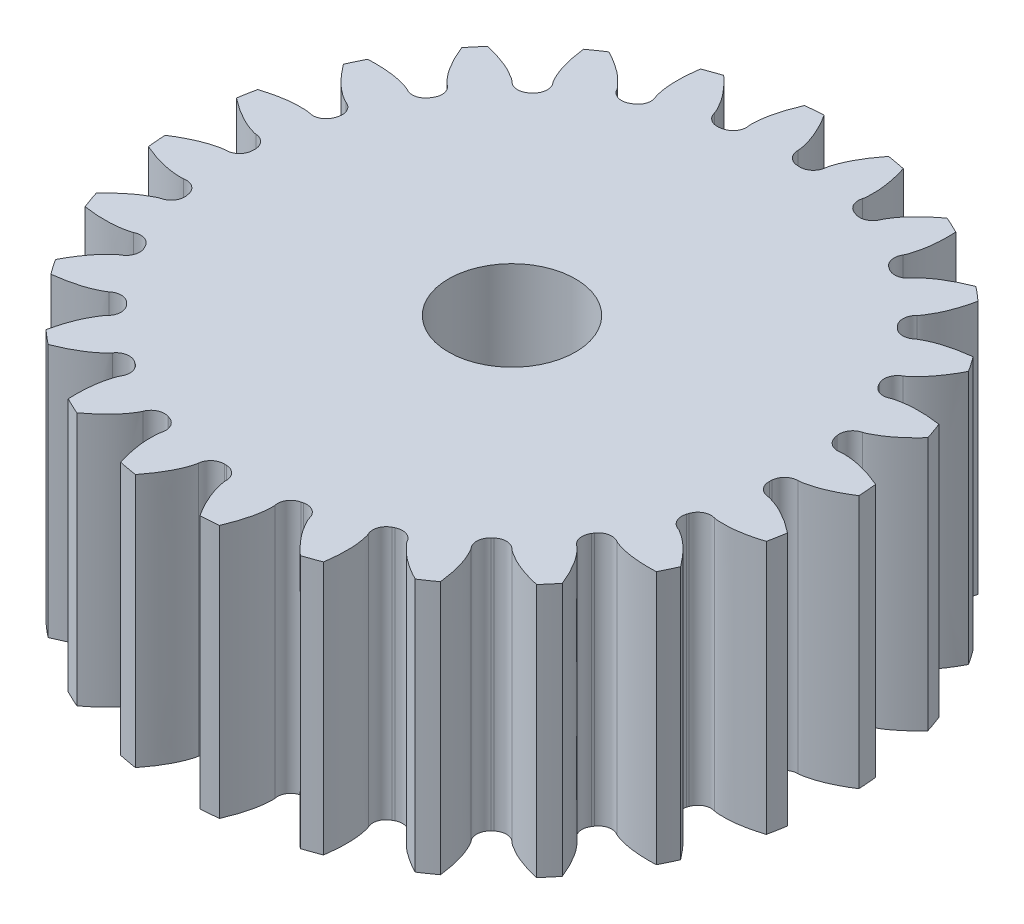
SolidWorks part; units mm, degrees
ref_plane "Face" through (0, 0, 0) normal (0, 0, 1) x (1, 0, 0)
ref_plane "Dessus" through (0, 0, 0) normal (0, 1, 0) x (1, 0, 0)
ref_plane "Droite" through (0, 0, 0) normal (1, 0, 0) x (0, 0, -1)
sketch "Esquisse1" plane through (0, 0, 0) normal (0, 1, 0) x (1, 0, 0)
  circle A0 centre (0, 0) radius 5.2
  circle A1 centre (0, 0) radius 1
  dimension "D1" = 10.4
  dimension "D2" = 2
extrude "Boss.-Extru.1" add sketch "Esquisse1" along normal blind 4
sketch "Esquisse2" plane through (0, 4, 0) normal (0, 1, 0) x (1, 0, 0)
  arc A0 (5.1928, 0.2742) -> (5.1697, 0.5603) centre (0, 0) ccw
  arc A1 (4.9449, 1.6088) -> (4.8486, 1.8792) centre (0, 0) ccw
  arc A2 (4.36, 2.8338) -> (4.197, 3.0701) centre (0, 0) ccw
  arc A3 (3.478, 3.8657) -> (3.2593, 4.0517) centre (0, 0) ccw
  arc A4 (2.359, 4.6342) -> (2.0996, 4.7573) centre (0, 0) ccw
  arc A5 (1.0792, 5.0868) -> (0.7968, 5.1386) centre (0, 0) ccw
  arc A6 (-0.2742, 5.1928) -> (-0.5603, 5.1697) centre (0, 0) ccw
  arc A7 (-1.6088, 4.9449) -> (-1.8792, 4.8486) centre (0, 0) ccw
  arc A8 (-2.8338, 4.36) -> (-3.0701, 4.197) centre (0, 0) ccw
  arc A9 (-3.8657, 3.478) -> (-4.0517, 3.2593) centre (0, 0) ccw
  arc A10 (-4.6342, 2.359) -> (-4.7573, 2.0996) centre (0, 0) ccw
  arc A11 (-5.0868, 1.0792) -> (-5.1386, 0.7968) centre (0, 0) ccw
  arc A12 (-5.1928, -0.2742) -> (-5.1697, -0.5603) centre (0, 0) ccw
  arc A13 (-4.9449, -1.6088) -> (-4.8486, -1.8792) centre (0, 0) ccw
  arc A14 (-4.36, -2.8338) -> (-4.197, -3.0701) centre (0, 0) ccw
  arc A15 (-3.478, -3.8657) -> (-3.2593, -4.0517) centre (0, 0) ccw
  arc A16 (-2.359, -4.6342) -> (-2.0996, -4.7573) centre (0, 0) ccw
  arc A17 (-1.0792, -5.0868) -> (-0.7968, -5.1386) centre (0, 0) ccw
  arc A18 (0.2742, -5.1928) -> (0.5603, -5.1697) centre (0, 0) ccw
  arc A19 (1.6088, -4.9449) -> (1.8792, -4.8486) centre (0, 0) ccw
  arc A20 (2.8338, -4.36) -> (3.0701, -4.197) centre (0, 0) ccw
  arc A21 (3.8657, -3.478) -> (4.0517, -3.2593) centre (0, 0) ccw
  arc A22 (4.6342, -2.359) -> (4.7573, -2.0996) centre (0, 0) ccw
  arc A23 (5.0868, -1.0792) -> (5.1386, -0.7968) centre (0, 0) ccw
  arc A24 (4.511, 0) -> (4.2953, -0.2011) centre (4.5061, -0.2109) ccw
  arc A25 (4.2937, -0.2334) -> (4.488, -0.4552) centre (4.5043, -0.2449) ccw
  arc A26 (4.2937, -0.2334) -> (4.2953, -0.2011) centre (0, 0) ccw
  arc A27 (4.3573, 1.1675) -> (4.201, 0.9175) centre (4.4071, 0.9625) ccw
  arc A28 (4.2078, 0.8858) -> (4.4529, 0.7218) centre (4.4142, 0.9293) ccw
  arc A29 (4.2078, 0.8858) -> (4.201, 0.9175) centre (0, 0) ccw
  arc A30 (3.9066, 2.2555) -> (3.8204, 1.9735) centre (4.0078, 2.0704) ccw
  arc A31 (3.8351, 1.9447) -> (4.1143, 1.8497) centre (4.0233, 2.0401) ccw
  arc A32 (3.8351, 1.9447) -> (3.8204, 1.9735) centre (0, 0) ccw
  arc A33 (3.1898, 3.1898) -> (3.1794, 2.8951) centre (3.3354, 3.0371) ccw
  arc A34 (3.2011, 2.871) -> (3.4954, 2.8516) centre (3.3582, 3.0119) ccw
  arc A35 (3.2011, 2.871) -> (3.1794, 2.8951) centre (0, 0) ccw
  arc A36 (2.2555, 3.9066) -> (2.3218, 3.6193) centre (2.4357, 3.7969) ccw
  arc A37 (2.349, 3.6017) -> (2.6382, 3.6591) centre (2.4642, 3.7784) ccw
  arc A38 (2.349, 3.6017) -> (2.3218, 3.6193) centre (0, 0) ccw
  arc A39 (1.1675, 4.3573) -> (1.3059, 4.0969) centre (1.37, 4.2979) ccw
  arc A40 (1.3367, 4.0869) -> (1.6013, 4.2172) centre (1.4023, 4.2875) ccw
  arc A41 (1.3367, 4.0869) -> (1.3059, 4.0969) centre (0, 0) ccw
  arc A42 (0, 4.511) -> (0.2011, 4.2953) centre (0.2109, 4.5061) ccw
  arc A43 (0.2334, 4.2937) -> (0.4552, 4.488) centre (0.2449, 4.5043) ccw
  arc A44 (0.2334, 4.2937) -> (0.2011, 4.2953) centre (0, 0) ccw
  arc A45 (-1.1675, 4.3573) -> (-0.9175, 4.201) centre (-0.9625, 4.4071) ccw
  arc A46 (-0.8858, 4.2078) -> (-0.7218, 4.4529) centre (-0.9293, 4.4142) ccw
  arc A47 (-0.8858, 4.2078) -> (-0.9175, 4.201) centre (0, 0) ccw
  arc A48 (-2.2555, 3.9066) -> (-1.9735, 3.8204) centre (-2.0704, 4.0078) ccw
  arc A49 (-1.9447, 3.8351) -> (-1.8497, 4.1143) centre (-2.0401, 4.0233) ccw
  arc A50 (-1.9447, 3.8351) -> (-1.9735, 3.8204) centre (0, 0) ccw
  arc A51 (-3.1898, 3.1898) -> (-2.8951, 3.1794) centre (-3.0371, 3.3354) ccw
  arc A52 (-2.871, 3.2011) -> (-2.8516, 3.4954) centre (-3.0119, 3.3582) ccw
  arc A53 (-2.871, 3.2011) -> (-2.8951, 3.1794) centre (0, 0) ccw
  arc A54 (-3.9066, 2.2555) -> (-3.6193, 2.3218) centre (-3.7969, 2.4357) ccw
  arc A55 (-3.6017, 2.349) -> (-3.6591, 2.6382) centre (-3.7784, 2.4642) ccw
  arc A56 (-3.6017, 2.349) -> (-3.6193, 2.3218) centre (0, 0) ccw
  arc A57 (-4.3573, 1.1675) -> (-4.0969, 1.3059) centre (-4.2979, 1.37) ccw
  arc A58 (-4.0869, 1.3367) -> (-4.2172, 1.6013) centre (-4.2875, 1.4023) ccw
  arc A59 (-4.0869, 1.3367) -> (-4.0969, 1.3059) centre (0, 0) ccw
  arc A60 (-4.511, 0) -> (-4.2953, 0.2011) centre (-4.5061, 0.2109) ccw
  arc A61 (-4.2937, 0.2334) -> (-4.488, 0.4552) centre (-4.5043, 0.2449) ccw
  arc A62 (-4.2937, 0.2334) -> (-4.2953, 0.2011) centre (0, 0) ccw
  arc A63 (-4.3573, -1.1675) -> (-4.201, -0.9175) centre (-4.4071, -0.9625) ccw
  arc A64 (-4.2078, -0.8858) -> (-4.4529, -0.7218) centre (-4.4142, -0.9293) ccw
  arc A65 (-4.2078, -0.8858) -> (-4.201, -0.9175) centre (0, 0) ccw
  arc A66 (-3.9066, -2.2555) -> (-3.8204, -1.9735) centre (-4.0078, -2.0704) ccw
  arc A67 (-3.8351, -1.9447) -> (-4.1143, -1.8497) centre (-4.0233, -2.0401) ccw
  arc A68 (-3.8351, -1.9447) -> (-3.8204, -1.9735) centre (0, 0) ccw
  arc A69 (-3.1898, -3.1898) -> (-3.1794, -2.8951) centre (-3.3354, -3.0371) ccw
  arc A70 (-3.2011, -2.871) -> (-3.4954, -2.8516) centre (-3.3582, -3.0119) ccw
  arc A71 (-3.2011, -2.871) -> (-3.1794, -2.8951) centre (0, 0) ccw
  arc A72 (-2.2555, -3.9066) -> (-2.3218, -3.6193) centre (-2.4357, -3.7969) ccw
  arc A73 (-2.349, -3.6017) -> (-2.6382, -3.6591) centre (-2.4642, -3.7784) ccw
  arc A74 (-2.349, -3.6017) -> (-2.3218, -3.6193) centre (0, 0) ccw
  arc A75 (-1.1675, -4.3573) -> (-1.3059, -4.0969) centre (-1.37, -4.2979) ccw
  arc A76 (-1.3367, -4.0869) -> (-1.6013, -4.2172) centre (-1.4023, -4.2875) ccw
  arc A77 (-1.3367, -4.0869) -> (-1.3059, -4.0969) centre (0, 0) ccw
  arc A78 (0, -4.511) -> (-0.2011, -4.2953) centre (-0.2109, -4.5061) ccw
  arc A79 (-0.2334, -4.2937) -> (-0.4552, -4.488) centre (-0.2449, -4.5043) ccw
  arc A80 (-0.2334, -4.2937) -> (-0.2011, -4.2953) centre (0, 0) ccw
  arc A81 (1.1675, -4.3573) -> (0.9175, -4.201) centre (0.9625, -4.4071) ccw
  arc A82 (0.8858, -4.2078) -> (0.7218, -4.4529) centre (0.9293, -4.4142) ccw
  arc A83 (0.8858, -4.2078) -> (0.9175, -4.201) centre (0, 0) ccw
  arc A84 (2.2555, -3.9066) -> (1.9735, -3.8204) centre (2.0704, -4.0078) ccw
  arc A85 (1.9447, -3.8351) -> (1.8497, -4.1143) centre (2.0401, -4.0233) ccw
  arc A86 (1.9447, -3.8351) -> (1.9735, -3.8204) centre (0, 0) ccw
  arc A87 (3.1898, -3.1898) -> (2.8951, -3.1794) centre (3.0371, -3.3354) ccw
  arc A88 (2.871, -3.2011) -> (2.8516, -3.4954) centre (3.0119, -3.3582) ccw
  arc A89 (2.871, -3.2011) -> (2.8951, -3.1794) centre (0, 0) ccw
  arc A90 (3.9066, -2.2555) -> (3.6193, -2.3218) centre (3.7969, -2.4357) ccw
  arc A91 (3.6017, -2.349) -> (3.6591, -2.6382) centre (3.7784, -2.4642) ccw
  arc A92 (3.6017, -2.349) -> (3.6193, -2.3218) centre (0, 0) ccw
  arc A93 (4.3573, -1.1675) -> (4.0969, -1.3059) centre (4.2979, -1.37) ccw
  arc A94 (4.0869, -1.3367) -> (4.2172, -1.6013) centre (4.2875, -1.4023) ccw
  arc A95 (4.0869, -1.3367) -> (4.0969, -1.3059) centre (0, 0) ccw
  spline S0 degree 3 poles (4.511, 0) (4.5342, 0) (4.6328, 0.0162) (4.7897, 0.0629) (4.9939, 0.1546) (5.1223, 0.2287) (5.1928, 0.2742) knots 0 0 0 0 0.069482 0.297905 0.489604 0.740188 0.740188 0.740188 0.740188
  spline S1 degree 3 poles (4.4529, 0.7218) (4.4757, 0.7256) (4.5757, 0.7253) (4.738, 0.7044) (4.9542, 0.6465) (5.0929, 0.5939) (5.1697, 0.5603) knots 0 0 0 0 0.069482 0.297905 0.489604 0.740188 0.740188 0.740188 0.740188
  spline S2 degree 3 poles (4.3573, 1.1675) (4.3797, 1.1735) (4.4707, 1.2147) (4.6102, 1.3004) (4.7837, 1.4419) (4.8885, 1.5466) (4.9449, 1.6088) knots 0 0 0 0 0.069482 0.297905 0.489604 0.740188 0.740188 0.740188 0.740188
  spline S3 degree 3 poles (4.1143, 1.8497) (4.1354, 1.8592) (4.232, 1.8849) (4.3943, 1.9067) (4.6181, 1.9067) (4.7656, 1.8918) (4.8486, 1.8792) knots 0 0 0 0 0.069482 0.297905 0.489604 0.740188 0.740188 0.740188 0.740188
  spline S4 degree 3 poles (3.9066, 2.2555) (3.9267, 2.2671) (4.004, 2.3304) (4.1166, 2.4493) (4.2475, 2.6308) (4.3217, 2.7592) (4.36, 2.8338) knots 0 0 0 0 0.069482 0.297905 0.489604 0.740188 0.740188 0.740188 0.740188
  spline S5 degree 3 poles (3.4954, 2.8516) (3.5133, 2.8662) (3.6, 2.916) (3.7511, 2.979) (3.9673, 3.037) (4.1136, 3.0608) (4.197, 3.0701) knots 0 0 0 0 0.069482 0.297905 0.489604 0.740188 0.740188 0.740188 0.740188
  spline S6 degree 3 poles (3.1898, 3.1898) (3.2061, 3.2061) (3.2644, 3.2873) (3.3424, 3.4313) (3.4218, 3.6405) (3.4603, 3.7837) (3.478, 3.8657) knots 0 0 0 0 0.069482 0.297905 0.489604 0.740188 0.740188 0.740188 0.740188
  spline S7 degree 3 poles (2.6382, 3.6591) (2.6518, 3.6779) (2.7226, 3.7484) (2.8522, 3.8484) (3.0461, 3.9603) (3.1812, 4.0212) (3.2593, 4.0517) knots 0 0 0 0 0.069482 0.297905 0.489604 0.740188 0.740188 0.740188 0.740188
  spline S8 degree 3 poles (2.2555, 3.9066) (2.2671, 3.9267) (2.3023, 4.0202) (2.3404, 4.1794) (2.363, 4.4021) (2.3631, 4.5504) (2.359, 4.6342) knots 0 0 0 0 0.069482 0.297905 0.489604 0.740188 0.740188 0.740188 0.740188
  spline S9 degree 3 poles (1.6013, 4.2172) (1.6095, 4.2389) (1.6597, 4.3253) (1.759, 4.4554) (1.9173, 4.6137) (2.0321, 4.7075) (2.0996, 4.7573) knots 0 0 0 0 0.069482 0.297905 0.489604 0.740188 0.740188 0.740188 0.740188
  spline S10 degree 3 poles (1.1675, 4.3573) (1.1735, 4.3797) (1.1834, 4.4791) (1.1789, 4.6428) (1.1431, 4.8637) (1.1048, 5.0069) (1.0792, 5.0868) knots 0 0 0 0 0.069482 0.297905 0.489604 0.740188 0.740188 0.740188 0.740188
  spline S11 degree 3 poles (0.4552, 4.488) (0.4576, 4.511) (0.4837, 4.6075) (0.5459, 4.7589) (0.6578, 4.9528) (0.7445, 5.073) (0.7968, 5.1386) knots 0 0 0 0 0.069482 0.297905 0.489604 0.740188 0.740188 0.740188 0.740188
  spline S12 degree 3 poles (0, 4.511) (0, 4.5342) (-0.0162, 4.6328) (-0.0629, 4.7897) (-0.1546, 4.9939) (-0.2287, 5.1223) (-0.2742, 5.1928) knots 0 0 0 0 0.069482 0.297905 0.489604 0.740188 0.740188 0.740188 0.740188
  spline S13 degree 3 poles (-0.7218, 4.4529) (-0.7256, 4.4757) (-0.7253, 4.5757) (-0.7044, 4.738) (-0.6465, 4.9542) (-0.5939, 5.0929) (-0.5603, 5.1697) knots 0 0 0 0 0.069482 0.297905 0.489604 0.740188 0.740188 0.740188 0.740188
  spline S14 degree 3 poles (-1.1675, 4.3573) (-1.1735, 4.3797) (-1.2147, 4.4707) (-1.3004, 4.6102) (-1.4419, 4.7837) (-1.5466, 4.8885) (-1.6088, 4.9449) knots 0 0 0 0 0.069482 0.297905 0.489604 0.740188 0.740188 0.740188 0.740188
  spline S15 degree 3 poles (-1.8497, 4.1143) (-1.8592, 4.1354) (-1.8849, 4.232) (-1.9067, 4.3943) (-1.9067, 4.6181) (-1.8918, 4.7656) (-1.8792, 4.8486) knots 0 0 0 0 0.069482 0.297905 0.489604 0.740188 0.740188 0.740188 0.740188
  spline S16 degree 3 poles (-2.2555, 3.9066) (-2.2671, 3.9267) (-2.3304, 4.004) (-2.4493, 4.1166) (-2.6308, 4.2475) (-2.7592, 4.3217) (-2.8338, 4.36) knots 0 0 0 0 0.069482 0.297905 0.489604 0.740188 0.740188 0.740188 0.740188
  spline S17 degree 3 poles (-2.8516, 3.4954) (-2.8662, 3.5133) (-2.916, 3.6) (-2.979, 3.7511) (-3.037, 3.9673) (-3.0608, 4.1136) (-3.0701, 4.197) knots 0 0 0 0 0.069482 0.297905 0.489604 0.740188 0.740188 0.740188 0.740188
  spline S18 degree 3 poles (-3.1898, 3.1898) (-3.2061, 3.2061) (-3.2873, 3.2644) (-3.4313, 3.3424) (-3.6405, 3.4218) (-3.7837, 3.4603) (-3.8657, 3.478) knots 0 0 0 0 0.069482 0.297905 0.489604 0.740188 0.740188 0.740188 0.740188
  spline S19 degree 3 poles (-3.6591, 2.6382) (-3.6779, 2.6518) (-3.7484, 2.7226) (-3.8484, 2.8522) (-3.9603, 3.0461) (-4.0212, 3.1812) (-4.0517, 3.2593) knots 0 0 0 0 0.069482 0.297905 0.489604 0.740188 0.740188 0.740188 0.740188
  spline S20 degree 3 poles (-3.9066, 2.2555) (-3.9267, 2.2671) (-4.0202, 2.3023) (-4.1794, 2.3404) (-4.4021, 2.363) (-4.5504, 2.3631) (-4.6342, 2.359) knots 0 0 0 0 0.069482 0.297905 0.489604 0.740188 0.740188 0.740188 0.740188
  spline S21 degree 3 poles (-4.2172, 1.6013) (-4.2389, 1.6095) (-4.3253, 1.6597) (-4.4554, 1.759) (-4.6137, 1.9173) (-4.7075, 2.0321) (-4.7573, 2.0996) knots 0 0 0 0 0.069482 0.297905 0.489604 0.740188 0.740188 0.740188 0.740188
  spline S22 degree 3 poles (-4.3573, 1.1675) (-4.3797, 1.1735) (-4.4791, 1.1834) (-4.6428, 1.1789) (-4.8637, 1.1431) (-5.0069, 1.1048) (-5.0868, 1.0792) knots 0 0 0 0 0.069482 0.297905 0.489604 0.740188 0.740188 0.740188 0.740188
  spline S23 degree 3 poles (-4.488, 0.4552) (-4.511, 0.4576) (-4.6075, 0.4837) (-4.7589, 0.5459) (-4.9528, 0.6578) (-5.073, 0.7445) (-5.1386, 0.7968) knots 0 0 0 0 0.069482 0.297905 0.489604 0.740188 0.740188 0.740188 0.740188
  spline S24 degree 3 poles (-4.511, 0) (-4.5342, 0) (-4.6328, -0.0162) (-4.7897, -0.0629) (-4.9939, -0.1546) (-5.1223, -0.2287) (-5.1928, -0.2742) knots 0 0 0 0 0.069482 0.297905 0.489604 0.740188 0.740188 0.740188 0.740188
  spline S25 degree 3 poles (-4.4529, -0.7218) (-4.4757, -0.7256) (-4.5757, -0.7253) (-4.738, -0.7044) (-4.9542, -0.6465) (-5.0929, -0.5939) (-5.1697, -0.5603) knots 0 0 0 0 0.069482 0.297905 0.489604 0.740188 0.740188 0.740188 0.740188
  spline S26 degree 3 poles (-4.3573, -1.1675) (-4.3797, -1.1735) (-4.4707, -1.2147) (-4.6102, -1.3004) (-4.7837, -1.4419) (-4.8885, -1.5466) (-4.9449, -1.6088) knots 0 0 0 0 0.069482 0.297905 0.489604 0.740188 0.740188 0.740188 0.740188
  spline S27 degree 3 poles (-4.1143, -1.8497) (-4.1354, -1.8592) (-4.232, -1.8849) (-4.3943, -1.9067) (-4.6181, -1.9067) (-4.7656, -1.8918) (-4.8486, -1.8792) knots 0 0 0 0 0.069482 0.297905 0.489604 0.740188 0.740188 0.740188 0.740188
  spline S28 degree 3 poles (-3.9066, -2.2555) (-3.9267, -2.2671) (-4.004, -2.3304) (-4.1166, -2.4493) (-4.2475, -2.6308) (-4.3217, -2.7592) (-4.36, -2.8338) knots 0 0 0 0 0.069482 0.297905 0.489604 0.740188 0.740188 0.740188 0.740188
  spline S29 degree 3 poles (-3.4954, -2.8516) (-3.5133, -2.8662) (-3.6, -2.916) (-3.7511, -2.979) (-3.9673, -3.037) (-4.1136, -3.0608) (-4.197, -3.0701) knots 0 0 0 0 0.069482 0.297905 0.489604 0.740188 0.740188 0.740188 0.740188
  spline S30 degree 3 poles (-3.1898, -3.1898) (-3.2061, -3.2061) (-3.2644, -3.2873) (-3.3424, -3.4313) (-3.4218, -3.6405) (-3.4603, -3.7837) (-3.478, -3.8657) knots 0 0 0 0 0.069482 0.297905 0.489604 0.740188 0.740188 0.740188 0.740188
  spline S31 degree 3 poles (-2.6382, -3.6591) (-2.6518, -3.6779) (-2.7226, -3.7484) (-2.8522, -3.8484) (-3.0461, -3.9603) (-3.1812, -4.0212) (-3.2593, -4.0517) knots 0 0 0 0 0.069482 0.297905 0.489604 0.740188 0.740188 0.740188 0.740188
  spline S32 degree 3 poles (-2.2555, -3.9066) (-2.2671, -3.9267) (-2.3023, -4.0202) (-2.3404, -4.1794) (-2.363, -4.4021) (-2.3631, -4.5504) (-2.359, -4.6342) knots 0 0 0 0 0.069482 0.297905 0.489604 0.740188 0.740188 0.740188 0.740188
  spline S33 degree 3 poles (-1.6013, -4.2172) (-1.6095, -4.2389) (-1.6597, -4.3253) (-1.759, -4.4554) (-1.9173, -4.6137) (-2.0321, -4.7075) (-2.0996, -4.7573) knots 0 0 0 0 0.069482 0.297905 0.489604 0.740188 0.740188 0.740188 0.740188
  spline S34 degree 3 poles (-1.1675, -4.3573) (-1.1735, -4.3797) (-1.1834, -4.4791) (-1.1789, -4.6428) (-1.1431, -4.8637) (-1.1048, -5.0069) (-1.0792, -5.0868) knots 0 0 0 0 0.069482 0.297905 0.489604 0.740188 0.740188 0.740188 0.740188
  spline S35 degree 3 poles (-0.4552, -4.488) (-0.4576, -4.511) (-0.4837, -4.6075) (-0.5459, -4.7589) (-0.6578, -4.9528) (-0.7445, -5.073) (-0.7968, -5.1386) knots 0 0 0 0 0.069482 0.297905 0.489604 0.740188 0.740188 0.740188 0.740188
  spline S36 degree 3 poles (0, -4.511) (0, -4.5342) (0.0162, -4.6328) (0.0629, -4.7897) (0.1546, -4.9939) (0.2287, -5.1223) (0.2742, -5.1928) knots 0 0 0 0 0.069482 0.297905 0.489604 0.740188 0.740188 0.740188 0.740188
  spline S37 degree 3 poles (0.7218, -4.4529) (0.7256, -4.4757) (0.7253, -4.5757) (0.7044, -4.738) (0.6465, -4.9542) (0.5939, -5.0929) (0.5603, -5.1697) knots 0 0 0 0 0.069482 0.297905 0.489604 0.740188 0.740188 0.740188 0.740188
  spline S38 degree 3 poles (1.1675, -4.3573) (1.1735, -4.3797) (1.2147, -4.4707) (1.3004, -4.6102) (1.4419, -4.7837) (1.5466, -4.8885) (1.6088, -4.9449) knots 0 0 0 0 0.069482 0.297905 0.489604 0.740188 0.740188 0.740188 0.740188
  spline S39 degree 3 poles (1.8497, -4.1143) (1.8592, -4.1354) (1.8849, -4.232) (1.9067, -4.3943) (1.9067, -4.6181) (1.8918, -4.7656) (1.8792, -4.8486) knots 0 0 0 0 0.069482 0.297905 0.489604 0.740188 0.740188 0.740188 0.740188
  spline S40 degree 3 poles (2.2555, -3.9066) (2.2671, -3.9267) (2.3304, -4.004) (2.4493, -4.1166) (2.6308, -4.2475) (2.7592, -4.3217) (2.8338, -4.36) knots 0 0 0 0 0.069482 0.297905 0.489604 0.740188 0.740188 0.740188 0.740188
  spline S41 degree 3 poles (2.8516, -3.4954) (2.8662, -3.5133) (2.916, -3.6) (2.979, -3.7511) (3.037, -3.9673) (3.0608, -4.1136) (3.0701, -4.197) knots 0 0 0 0 0.069482 0.297905 0.489604 0.740188 0.740188 0.740188 0.740188
  spline S42 degree 3 poles (3.1898, -3.1898) (3.2061, -3.2061) (3.2873, -3.2644) (3.4313, -3.3424) (3.6405, -3.4218) (3.7837, -3.4603) (3.8657, -3.478) knots 0 0 0 0 0.069482 0.297905 0.489604 0.740188 0.740188 0.740188 0.740188
  spline S43 degree 3 poles (3.6591, -2.6382) (3.6779, -2.6518) (3.7484, -2.7226) (3.8484, -2.8522) (3.9603, -3.0461) (4.0212, -3.1812) (4.0517, -3.2593) knots 0 0 0 0 0.069482 0.297905 0.489604 0.740188 0.740188 0.740188 0.740188
  spline S44 degree 3 poles (3.9066, -2.2555) (3.9267, -2.2671) (4.0202, -2.3023) (4.1794, -2.3404) (4.4021, -2.363) (4.5504, -2.3631) (4.6342, -2.359) knots 0 0 0 0 0.069482 0.297905 0.489604 0.740188 0.740188 0.740188 0.740188
  spline S45 degree 3 poles (4.2172, -1.6013) (4.2389, -1.6095) (4.3253, -1.6597) (4.4554, -1.759) (4.6137, -1.9173) (4.7075, -2.0321) (4.7573, -2.0996) knots 0 0 0 0 0.069482 0.297905 0.489604 0.740188 0.740188 0.740188 0.740188
  spline S46 degree 3 poles (4.3573, -1.1675) (4.3797, -1.1735) (4.4791, -1.1834) (4.6428, -1.1789) (4.8637, -1.1431) (5.0069, -1.1048) (5.0868, -1.0792) knots 0 0 0 0 0.069482 0.297905 0.489604 0.740188 0.740188 0.740188 0.740188
  spline S47 degree 3 poles (4.488, -0.4552) (4.511, -0.4576) (4.6075, -0.4837) (4.7589, -0.5459) (4.9528, -0.6578) (5.073, -0.7445) (5.1386, -0.7968) knots 0 0 0 0 0.069482 0.297905 0.489604 0.740188 0.740188 0.740188 0.740188
  point P3 (4.511, 0)
  point P4 (4.58, 0.0082)
  point P5 (4.7995, 0.0715)
  point P6 (4.9748, 0.1491)
  point P7 (5.484, 0.4913)
  point P8 (6.9869, 5.7063)
extrude "Enlèv. mat.-Extru.1" cut sketch "Esquisse2" against normal through all flip side to cut
